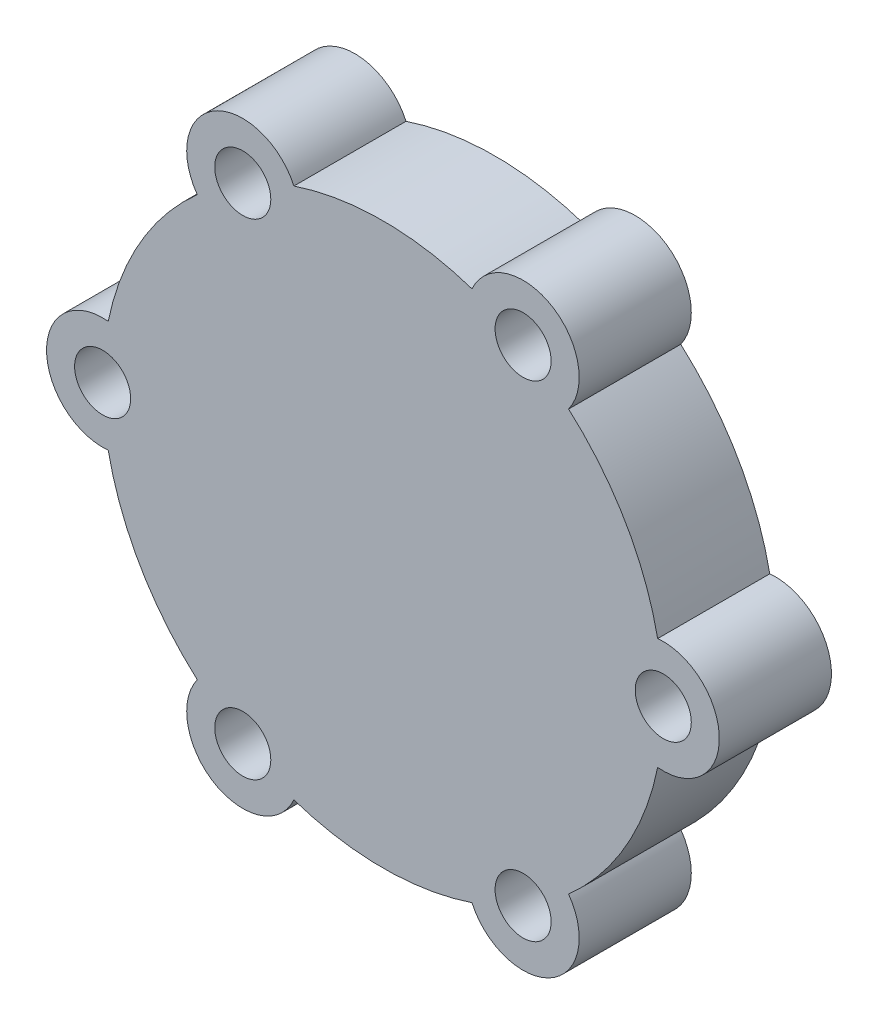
SolidWorks part; units mm, degrees
ref_plane "Front Plane" through (0, 0, 0) normal (0, 0, 1) x (1, 0, 0)
ref_plane "Top Plane" through (0, 0, 0) normal (0, 1, 0) x (1, 0, 0)
ref_plane "Right Plane" through (0, 0, 0) normal (1, 0, 0) x (0, 0, -1)
sketch "Sketch1" plane through (0, 0, 0) normal (0, 0, 1) x (1, 0, 0)
  arc A0 (119, 79.9499) -> (103.1168, 107.4603) centre (70, 70) ccw
  arc A1 (119, 60.0501) -> (119, 79.9499) centre (120, 70) ccw
  arc A2 (85.8832, 22.5898) -> (103.1168, 32.5397) centre (95, 26.6987) ccw
  arc A3 (36.8832, 32.5397) -> (54.1168, 22.5898) centre (45, 26.6987) ccw
  arc A4 (21, 79.9499) -> (21, 60.0501) centre (20, 70) ccw
  arc A5 (54.1168, 117.4102) -> (36.8832, 107.4603) centre (45, 113.3013) ccw
  arc A6 (103.1168, 107.4603) -> (85.8832, 117.4102) centre (95, 113.3013) ccw
  arc A7 (21, 60.0501) -> (36.8832, 32.5397) centre (70, 70) ccw
  arc A8 (36.8832, 107.4603) -> (21, 79.9499) centre (70, 70) ccw
  arc A9 (85.8832, 117.4102) -> (54.1168, 117.4102) centre (70, 70) ccw
  arc A10 (103.1168, 32.5397) -> (119, 60.0501) centre (70, 70) ccw
  arc A11 (54.1168, 22.5898) -> (85.8832, 22.5898) centre (70, 70) ccw
  circle A12 centre (20, 70) radius 5
  circle A13 centre (45, 113.3013) radius 5
  circle A14 centre (95, 113.3013) radius 5
  circle A15 centre (120, 70) radius 5
  circle A16 centre (95, 26.6987) radius 5
  circle A17 centre (45, 26.6987) radius 5
  point P3 (0, 0)
  point P22 (70, 70)
  point P34 (70, 70)
  dimension "D2" = 6
  dimension "D5" = 10
  dimension "D6" = 50
  dimension "D7" = 10
  dimension "D3" = 70
  dimension "D4" = 70
  dimension "D1" = 6
extrude "Boss-Extrude1" add sketch "Sketch1" along normal blind 20
